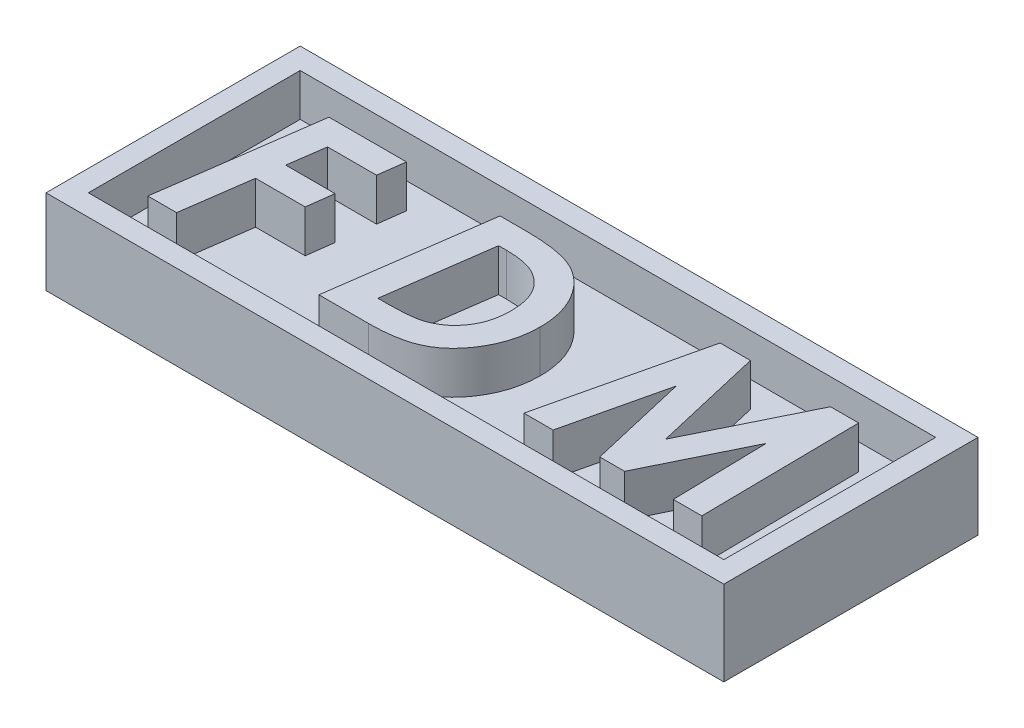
SolidWorks part; units mm, degrees
ref_plane "Front Plane" through (0, 0, 0) normal (0, 0, 1) x (1, 0, 0)
ref_plane "Top Plane" through (0, 0, 0) normal (0, 1, 0) x (1, 0, 0)
ref_plane "Right Plane" through (0, 0, 0) normal (1, 0, 0) x (0, 0, -1)
sketch "Sketch1" plane through (0, 0, 0) normal (0, 1, 0) x (1, 0, 0)
  line L1 (-20.32, -7.62) -> (20.32, -7.62)
  line L2 (-20.32, -7.62) -> (-20.32, 7.62)
  line L3 (-20.32, 7.62) -> (20.32, 7.62)
  line L4 (20.32, -7.62) -> (20.32, 7.62)
  line L5 (-20.32, -7.62) -> (20.32, 7.62) construction
  line L6 (-20.32, 7.62) -> (20.32, -7.62) construction
  point P0 (0, 0)
  dimension "D1" = 40.64
  dimension "D2" = 15.24
extrude "Boss-Extrude1" add sketch "Sketch1" along normal blind 5.08
sketch "Sketch2" plane through (0, 5.08, 0) normal (0, 1, 0) x (1, 0, 0)
  line L1 (-19.05, -6.35) -> (19.05, -6.35)
  line L2 (-19.05, -6.35) -> (-19.05, 6.35)
  line L3 (-19.05, 6.35) -> (19.05, 6.35)
  line L4 (19.05, -6.35) -> (19.05, 6.35)
  line L5 (-19.05, -6.35) -> (19.05, 6.35) construction
  line L6 (-19.05, 6.35) -> (19.05, -6.35) construction
  point P0 (0, 0)
  dimension "D1" = 38.1
  dimension "D2" = 12.7
extrude "Cut-Extrude1" cut sketch "Sketch2" against normal blind 2.54
sketch "Sketch4" plane through (0, 2.54, 0) normal (0, 1, 0) x (1, 0, 0)
  text T0 "<b>F D M </b>" font "Century Gothic" height in points 36
extrude "Boss-Extrude2" add sketch "Sketch4" along normal blind 2.54
sketch "Sketch5" plane through (0, 2.54, 0) normal (0, 1, 0) x (1, 0, 0)
  line L1 (19.05, 6.35) -> (16.8722, 6.35)
  line L2 (19.05, 6.35) -> (19.05, 4.7714)
  line L3 (19.05, 4.7714) -> (16.8722, 4.7714)
  line L4 (16.8722, 6.35) -> (16.8722, 4.7714)
extrude "Cut-Extrude2" cut sketch "Sketch5" against normal blind 5.08
